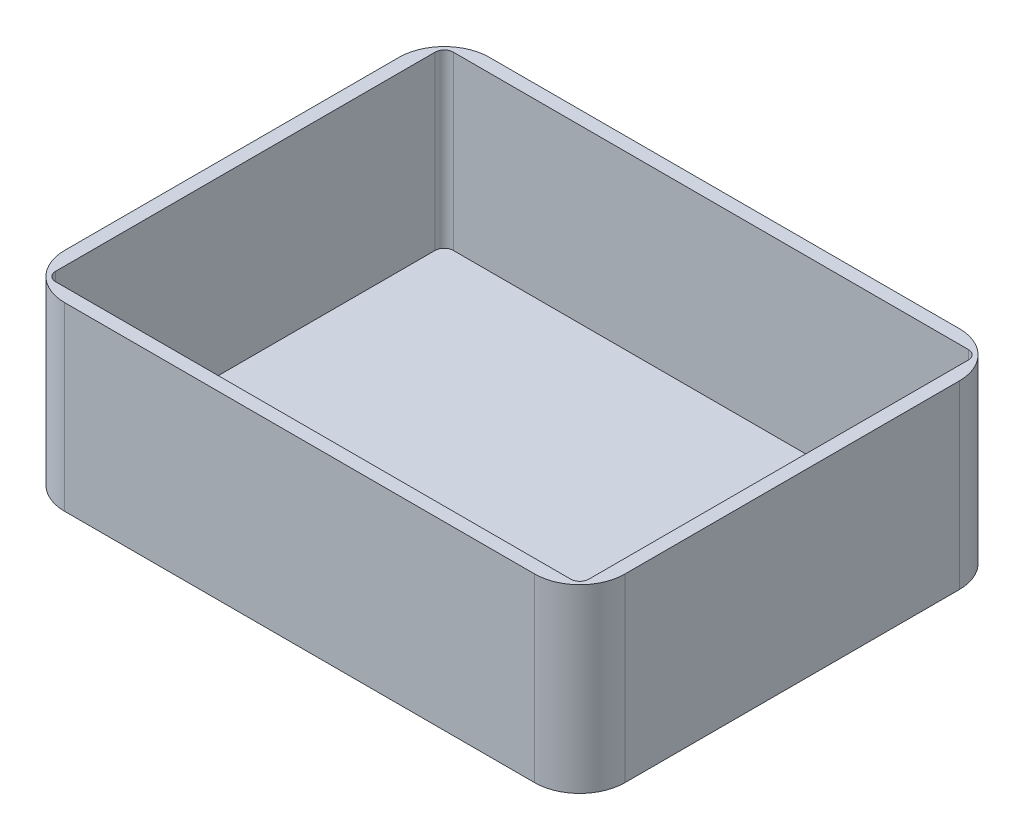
SolidWorks part; units mm, degrees
ref_plane "Front Plane" through (0, 0, 0) normal (0, 0, 1) x (1, 0, 0)
ref_plane "Top Plane" through (0, 0, 0) normal (0, 1, 0) x (1, 0, 0)
ref_plane "Right Plane" through (0, 0, 0) normal (1, 0, 0) x (0, 0, -1)
sketch "Sketch1" plane through (0, 0, 0) normal (0, 1, 0) x (1, 0, 0)
  line L1 (-62, 47) -> (62, 47)
  line L2 (-62, 47) -> (-62, -47)
  line L3 (-62, -47) -> (62, -47)
  line L4 (62, 47) -> (62, -47)
  line L5 (-62, 47) -> (62, -47) construction
  line L6 (-62, -47) -> (62, 47) construction
  point P0 (0, 0)
extrude "Boss-Extrude1" add sketch "Sketch1" along normal blind 40
sketch "Sketch2" plane through (0, 40, 0) normal (0, 1, 0) x (1, 0, 0)
  line L1 (-59, 44) -> (59, 44)
  line L2 (-59, 44) -> (-59, -44)
  line L3 (-59, -44) -> (59, -44)
  line L4 (59, 44) -> (59, -44)
  line L5 (-59, 44) -> (59, -44) construction
  line L6 (-59, -44) -> (59, 44) construction
  point P0 (0, 0)
extrude "Cut-Extrude1" cut sketch "Sketch2" against normal blind 38
fillet "Fillet2" radius 10 4 edges at (-62, 20, -47) (62, 20, -47) (62, 20, 47) (-62, 20, 47)
fillet "Fillet3" radius 2 4 edges at (-59, 21, -44) (-59, 21, 44) (59, 21, 44) (59, 21, -44)
